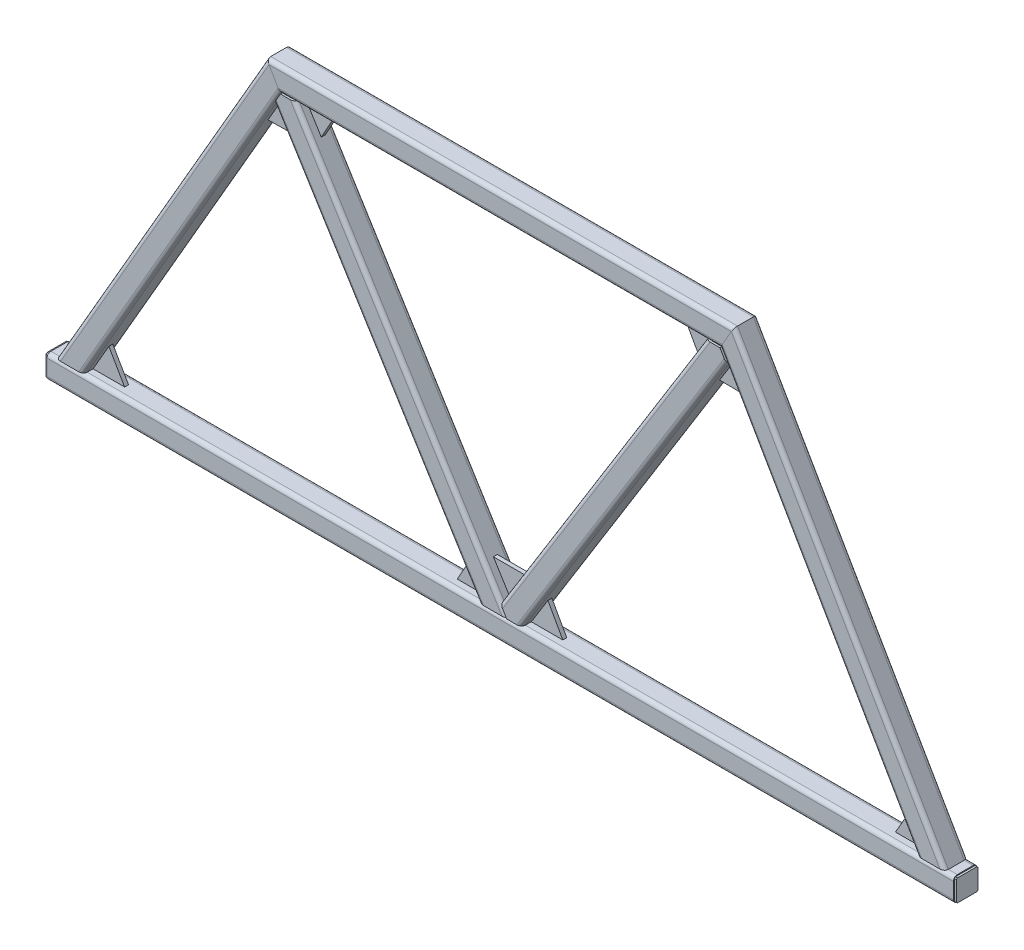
SolidWorks part; units mm, degrees
ref_plane "Front Plane" through (0, 0, 0) normal (0, 0, 1) x (1, 0, 0)
ref_plane "Top Plane" through (0, 0, 0) normal (0, 1, 0) x (1, 0, 0)
ref_plane "Right Plane" through (0, 0, 0) normal (1, 0, 0) x (0, 0, -1)
sketch "Sketch 01" plane through (0, 0, 0) normal (0, 0, 1) x (1, 0, 0)
  line L0 (-1460.5, 0) -> (1460.5, 0)
  dimension "D1" = 2921
  dimension "D2" = 1460.5
sketch "Sketch 02" plane through (0, 0, 0) normal (0, 0, 1) x (1, 0, 0)
  line L0 (-1409.7, 0) -> (-730.25, 1176.8419)
  line L1 (1409.7, 0) -> (730.25, 1176.8419)
  line L2 (-730.25, 1176.8419) -> (730.25, 1176.8419)
  line L5 (-1460.5, 0) -> (1460.5, 0) construction
  dimension "D1" = 50.8
  dimension "D2" = 50.8
  dimension "D3" = 60
  dimension "D4" = 60
  dimension "D5" = 1460.5
sketch "Sketch16" plane through (0, 0, 0) normal (0, 0, 1) x (1, 0, 0)
  line L0 (-730.25, 1176.8419) -> (0, 0)
  line L1 (-1460.5, 0) -> (1460.5, 0) construction
  line L2 (730.25, 1176.8419) -> (0, 0)
other "Structural Member1"
ref_plane "Plane1" through (-1460.5, 0, 0) normal (1, 0, 0) x (0, 1, 0)
sketch "Sketch1" plane through (-1460.5, 0, 0) normal (1, 0, 0) x (0, 1, 0)
  line L0 (-25.4, -31.75) -> (25.4, -31.75)
  line L1 (-31.75, -25.4) -> (-31.75, 25.4)
  line L2 (25.4, 31.75) -> (-25.4, 31.75)
  line L3 (31.75, 25.4) -> (31.75, -25.4)
  line L4 (-25.4, -38.1) -> (25.4, -38.1)
  line L5 (-38.1, -25.4) -> (-38.1, 25.4)
  line L6 (25.4, 38.1) -> (-25.4, 38.1)
  line L7 (38.1, 25.4) -> (38.1, -25.4)
  line L8 (0, 0) -> (31.75, 0) construction
  line L9 (0, 0) -> (0, 31.75) construction
  arc A0 (38.1, 25.4) -> (25.4, 38.1) centre (25.4, 25.4) ccw
  arc A1 (25.4, -38.1) -> (38.1, -25.4) centre (25.4, -25.4) ccw
  arc A2 (-38.1, -25.4) -> (-25.4, -38.1) centre (-25.4, -25.4) ccw
  arc A3 (-25.4, 38.1) -> (-38.1, 25.4) centre (-25.4, 25.4) ccw
  arc A4 (-25.4, 31.75) -> (-31.75, 25.4) centre (-25.4, 25.4) ccw
  arc A5 (31.75, 25.4) -> (25.4, 31.75) centre (25.4, 25.4) ccw
  arc A6 (25.4, -31.75) -> (31.75, -25.4) centre (25.4, -25.4) ccw
  arc A7 (-31.75, -25.4) -> (-25.4, -31.75) centre (-25.4, -25.4) ccw
  point P3 (0, 38.1)
  point P4 (38.1, 0)
  point P5 (0, -38.1)
  point P6 (-38.1, 0)
  point P7 (-38.1, 38.1)
  point P8 (-38.1, -38.1)
  point P33 (0, 0)
  point P35 (38.1, -38.1)
  point P36 (38.1, 38.1)
  point P37 (0, 0)
  dimension "D1" = 12.7
  dimension "Thickness" = 6.35
  dimension "V_leg" = 76.2
other "Structural Member2"
ref_plane "Plane2" through (1409.7, 0, 0) normal (-0.5, 0.866, 0) x (-0.866, -0.5, 0)
sketch "Sketch18" plane through (1409.7, 0, 0) normal (-0.5, 0.866, 0) x (-0.866, -0.5, 0)
  line L0 (-25.4, -31.75) -> (25.4, -31.75)
  line L1 (-31.75, -25.4) -> (-31.75, 25.4)
  line L2 (25.4, 31.75) -> (-25.4, 31.75)
  line L3 (31.75, 25.4) -> (31.75, -25.4)
  line L4 (-25.4, -38.1) -> (25.4, -38.1)
  line L5 (-38.1, -25.4) -> (-38.1, 25.4)
  line L6 (25.4, 38.1) -> (-25.4, 38.1)
  line L7 (38.1, 25.4) -> (38.1, -25.4)
  line L8 (0, 0) -> (31.75, 0) construction
  line L9 (0, 0) -> (0, 31.75) construction
  arc A0 (38.1, 25.4) -> (25.4, 38.1) centre (25.4, 25.4) ccw
  arc A1 (25.4, -38.1) -> (38.1, -25.4) centre (25.4, -25.4) ccw
  arc A2 (-38.1, -25.4) -> (-25.4, -38.1) centre (-25.4, -25.4) ccw
  arc A3 (-25.4, 38.1) -> (-38.1, 25.4) centre (-25.4, 25.4) ccw
  arc A4 (-25.4, 31.75) -> (-31.75, 25.4) centre (-25.4, 25.4) ccw
  arc A5 (31.75, 25.4) -> (25.4, 31.75) centre (25.4, 25.4) ccw
  arc A6 (25.4, -31.75) -> (31.75, -25.4) centre (25.4, -25.4) ccw
  arc A7 (-31.75, -25.4) -> (-25.4, -31.75) centre (-25.4, -25.4) ccw
  point P3 (0, 38.1)
  point P4 (38.1, 0)
  point P5 (0, -38.1)
  point P6 (-38.1, 0)
  point P7 (-38.1, 38.1)
  point P8 (-38.1, -38.1)
  point P33 (0, 0)
  point P35 (38.1, -38.1)
  point P36 (38.1, 38.1)
  point P37 (0, 0)
  dimension "D1" = 12.7
  dimension "Thickness" = 6.35
  dimension "V_leg" = 76.2
other "Structural Member3"
ref_plane "Plane3" through (-730.25, 1176.8419, 0) normal (1, 0, 0) x (0, 1, 0)
sketch "Sketch110" plane through (-730.25, 1176.8419, 0) normal (1, 0, 0) x (0, 1, 0)
  line L0 (-25.4, -31.75) -> (25.4, -31.75)
  line L1 (-31.75, -25.4) -> (-31.75, 25.4)
  line L2 (25.4, 31.75) -> (-25.4, 31.75)
  line L3 (31.75, 25.4) -> (31.75, -25.4)
  line L4 (-25.4, -38.1) -> (25.4, -38.1)
  line L5 (-38.1, -25.4) -> (-38.1, 25.4)
  line L6 (25.4, 38.1) -> (-25.4, 38.1)
  line L7 (38.1, 25.4) -> (38.1, -25.4)
  line L8 (0, 0) -> (31.75, 0) construction
  line L9 (0, 0) -> (0, 31.75) construction
  arc A0 (38.1, 25.4) -> (25.4, 38.1) centre (25.4, 25.4) ccw
  arc A1 (25.4, -38.1) -> (38.1, -25.4) centre (25.4, -25.4) ccw
  arc A2 (-38.1, -25.4) -> (-25.4, -38.1) centre (-25.4, -25.4) ccw
  arc A3 (-25.4, 38.1) -> (-38.1, 25.4) centre (-25.4, 25.4) ccw
  arc A4 (-25.4, 31.75) -> (-31.75, 25.4) centre (-25.4, 25.4) ccw
  arc A5 (31.75, 25.4) -> (25.4, 31.75) centre (25.4, 25.4) ccw
  arc A6 (25.4, -31.75) -> (31.75, -25.4) centre (25.4, -25.4) ccw
  arc A7 (-31.75, -25.4) -> (-25.4, -31.75) centre (-25.4, -25.4) ccw
  point P3 (0, 38.1)
  point P4 (38.1, 0)
  point P5 (0, -38.1)
  point P6 (-38.1, 0)
  point P7 (-38.1, 38.1)
  point P8 (-38.1, -38.1)
  point P33 (0, 0)
  point P35 (38.1, -38.1)
  point P36 (38.1, 38.1)
  point P37 (0, 0)
  dimension "D1" = 12.7
  dimension "Thickness" = 6.35
  dimension "V_leg" = 76.2
other "Structural Member4"
ref_plane "Plane4" through (-1409.7, 0, 0) normal (0.5, 0.866, 0) x (-0.866, 0.5, 0)
sketch "Sketch111" plane through (-1409.7, 0, 0) normal (0.5, 0.866, 0) x (-0.866, 0.5, 0)
  line L0 (-25.4, -31.75) -> (25.4, -31.75)
  line L1 (-31.75, -25.4) -> (-31.75, 25.4)
  line L2 (25.4, 31.75) -> (-25.4, 31.75)
  line L3 (31.75, 25.4) -> (31.75, -25.4)
  line L4 (-25.4, -38.1) -> (25.4, -38.1)
  line L5 (-38.1, -25.4) -> (-38.1, 25.4)
  line L6 (25.4, 38.1) -> (-25.4, 38.1)
  line L7 (38.1, 25.4) -> (38.1, -25.4)
  line L8 (0, 0) -> (31.75, 0) construction
  line L9 (0, 0) -> (0, 31.75) construction
  arc A0 (38.1, 25.4) -> (25.4, 38.1) centre (25.4, 25.4) ccw
  arc A1 (25.4, -38.1) -> (38.1, -25.4) centre (25.4, -25.4) ccw
  arc A2 (-38.1, -25.4) -> (-25.4, -38.1) centre (-25.4, -25.4) ccw
  arc A3 (-25.4, 38.1) -> (-38.1, 25.4) centre (-25.4, 25.4) ccw
  arc A4 (-25.4, 31.75) -> (-31.75, 25.4) centre (-25.4, 25.4) ccw
  arc A5 (31.75, 25.4) -> (25.4, 31.75) centre (25.4, 25.4) ccw
  arc A6 (25.4, -31.75) -> (31.75, -25.4) centre (25.4, -25.4) ccw
  arc A7 (-31.75, -25.4) -> (-25.4, -31.75) centre (-25.4, -25.4) ccw
  point P3 (0, 38.1)
  point P4 (38.1, 0)
  point P5 (0, -38.1)
  point P6 (-38.1, 0)
  point P7 (-38.1, 38.1)
  point P8 (-38.1, -38.1)
  point P33 (0, 0)
  point P35 (38.1, -38.1)
  point P36 (38.1, 38.1)
  point P37 (0, 0)
  dimension "D1" = 12.7
  dimension "Thickness" = 6.35
  dimension "V_leg" = 76.2
other "Structural Member5"
ref_plane "Plane5" through (-730.25, 1176.8419, 0) normal (0.5273, -0.8497, 0) x (0.8497, 0.5273, 0)
sketch "Sketch112" plane through (-730.25, 1176.8419, 0) normal (0.5273, -0.8497, 0) x (0.8497, 0.5273, 0)
  line L0 (-25.4, -31.75) -> (25.4, -31.75)
  line L1 (-31.75, -25.4) -> (-31.75, 25.4)
  line L2 (25.4, 31.75) -> (-25.4, 31.75)
  line L3 (31.75, 25.4) -> (31.75, -25.4)
  line L4 (-25.4, -38.1) -> (25.4, -38.1)
  line L5 (-38.1, -25.4) -> (-38.1, 25.4)
  line L6 (25.4, 38.1) -> (-25.4, 38.1)
  line L7 (38.1, 25.4) -> (38.1, -25.4)
  line L8 (0, 0) -> (31.75, 0) construction
  line L9 (0, 0) -> (0, 31.75) construction
  arc A0 (38.1, 25.4) -> (25.4, 38.1) centre (25.4, 25.4) ccw
  arc A1 (25.4, -38.1) -> (38.1, -25.4) centre (25.4, -25.4) ccw
  arc A2 (-38.1, -25.4) -> (-25.4, -38.1) centre (-25.4, -25.4) ccw
  arc A3 (-25.4, 38.1) -> (-38.1, 25.4) centre (-25.4, 25.4) ccw
  arc A4 (-25.4, 31.75) -> (-31.75, 25.4) centre (-25.4, 25.4) ccw
  arc A5 (31.75, 25.4) -> (25.4, 31.75) centre (25.4, 25.4) ccw
  arc A6 (25.4, -31.75) -> (31.75, -25.4) centre (25.4, -25.4) ccw
  arc A7 (-31.75, -25.4) -> (-25.4, -31.75) centre (-25.4, -25.4) ccw
  point P3 (0, 38.1)
  point P4 (38.1, 0)
  point P5 (0, -38.1)
  point P6 (-38.1, 0)
  point P7 (-38.1, 38.1)
  point P8 (-38.1, -38.1)
  point P33 (0, 0)
  point P35 (38.1, -38.1)
  point P36 (38.1, 38.1)
  point P37 (0, 0)
  dimension "D1" = 12.7
  dimension "Thickness" = 6.35
  dimension "V_leg" = 76.2
other "Structural Member6"
ref_plane "Plane6" through (730.25, 1176.8419, 0) normal (-0.5273, -0.8497, 0) x (0.8497, -0.5273, 0)
sketch "Sketch113" plane through (730.25, 1176.8419, 0) normal (-0.5273, -0.8497, 0) x (0.8497, -0.5273, 0)
  line L0 (-25.4, -31.75) -> (25.4, -31.75)
  line L1 (-31.75, -25.4) -> (-31.75, 25.4)
  line L2 (25.4, 31.75) -> (-25.4, 31.75)
  line L3 (31.75, 25.4) -> (31.75, -25.4)
  line L4 (-25.4, -38.1) -> (25.4, -38.1)
  line L5 (-38.1, -25.4) -> (-38.1, 25.4)
  line L6 (25.4, 38.1) -> (-25.4, 38.1)
  line L7 (38.1, 25.4) -> (38.1, -25.4)
  line L8 (0, 0) -> (31.75, 0) construction
  line L9 (0, 0) -> (0, 31.75) construction
  arc A0 (38.1, 25.4) -> (25.4, 38.1) centre (25.4, 25.4) ccw
  arc A1 (25.4, -38.1) -> (38.1, -25.4) centre (25.4, -25.4) ccw
  arc A2 (-38.1, -25.4) -> (-25.4, -38.1) centre (-25.4, -25.4) ccw
  arc A3 (-25.4, 38.1) -> (-38.1, 25.4) centre (-25.4, 25.4) ccw
  arc A4 (-25.4, 31.75) -> (-31.75, 25.4) centre (-25.4, 25.4) ccw
  arc A5 (31.75, 25.4) -> (25.4, 31.75) centre (25.4, 25.4) ccw
  arc A6 (25.4, -31.75) -> (31.75, -25.4) centre (25.4, -25.4) ccw
  arc A7 (-31.75, -25.4) -> (-25.4, -31.75) centre (-25.4, -25.4) ccw
  point P3 (0, 38.1)
  point P4 (38.1, 0)
  point P5 (0, -38.1)
  point P6 (-38.1, 0)
  point P7 (-38.1, 38.1)
  point P8 (-38.1, -38.1)
  point P33 (0, 0)
  point P35 (38.1, -38.1)
  point P36 (38.1, 38.1)
  point P37 (0, 0)
  dimension "D1" = 12.7
  dimension "Thickness" = 6.35
  dimension "V_leg" = 76.2
other "Trim/Extend1"
other "Trim/Extend2"
other "Trim/Extend3"
other "Trim/Extend4"
other "Trim/Extend5"
other "Trim/Extend6"
other "Trim/Extend7"
other "Trim/Extend8"
other "Gusset6" parameters "D1"=12.7, "D2"=12.7, "D3"=0, "D4"=0, "D10"=6.35, "D11"=101.6, "D12"=101.6, "D13"=12.7, "D14"=45, "D15"=12.7, "D16"=50.8, "D17"=50.8, "D18"=45
sketch "Sketch119" plane through (-729.0719, 1102.6825, -6.35) normal (0, 0, 1) x (1, 0, 0)
  line L0 (0, 0) -> (53.5693, -86.3301)
  line L1 (0, 0) -> (-50.8, -87.9882)
  line L2 (53.5693, -86.3301) -> (-50.8, -87.9882)
other "Gusset7" parameters "D1"=12.7, "D2"=12.7, "D3"=0, "D4"=0, "D10"=6.35, "D11"=101.6, "D12"=101.6, "D13"=12.7, "D14"=45, "D15"=12.7
sketch "Sketch120" plane through (-661.7693, 1138.7419, 6.35) normal (0, 0, -1) x (-1, 0, 0)
  line L0 (0, 0) -> (-53.5693, -86.3301)
  line L1 (0, 0) -> (-101.6, 0)
  line L2 (-53.5693, -86.3301) -> (-101.6, 0)
other "Gusset8" parameters "D1"=12.7, "D2"=12.7, "D3"=0, "D4"=0, "D10"=6.35, "D11"=101.6, "D12"=101.6, "D13"=12.7, "D14"=45, "D15"=12.7
sketch "Sketch121" plane through (661.7693, 1138.7419, -6.35) normal (0, 0, 1) x (1, 0, 0)
  line L0 (0, 0) -> (-101.6, 0)
  line L1 (0, 0) -> (-53.5693, -86.3301)
  line L2 (-101.6, 0) -> (-53.5693, -86.3301)
other "Gusset9" parameters "D1"=12.7, "D2"=12.7, "D3"=0, "D4"=0, "D10"=6.35, "D11"=101.6, "D12"=101.6, "D13"=12.7, "D14"=45, "D15"=12.7
sketch "Sketch122" plane through (729.0719, 1102.6825, 6.35) normal (0, 0, -1) x (-1, 0, 0)
  line L0 (0, 0) -> (-50.8, -87.9882)
  line L1 (0, 0) -> (53.5693, -86.3301)
  line L2 (-50.8, -87.9882) -> (53.5693, -86.3301)
other "Gusset1" parameters "D1"=12.7, "D2"=25.4, "D3"=0, "D4"=0, "D10"=6.35, "D11"=101.6, "D12"=101.6, "D13"=12.7, "D14"=45, "D15"=12.7
sketch "Sketch114" plane through (-1343.7089, 38.1, -6.35) normal (0, 0, 1) x (1, 0, 0)
  line L0 (0, 0) -> (50.8, 87.9882)
  line L1 (0, 0) -> (101.6, 0)
  line L2 (50.8, 87.9882) -> (101.6, 0)
other "Gusset2" parameters "D1"=12.7, "D2"=12.7, "D3"=0, "D4"=0, "D10"=6.35, "D11"=101.6, "D12"=101.6, "D13"=12.7, "D14"=45, "D15"=12.7
sketch "Sketch115" plane through (-68.4807, 38.1, 6.35) normal (0, 0, -1) x (-1, 0, 0)
  line L0 (0, 0) -> (101.6, 0)
  line L1 (0, 0) -> (53.5693, 86.3301)
  line L2 (101.6, 0) -> (53.5693, 86.3301)
other "Gusset3" parameters "D1"=12.7, "D2"=12.7, "D3"=0, "D4"=0, "D10"=6.35, "D11"=101.6, "D12"=101.6, "D13"=12.7, "D14"=45, "D15"=12.7
sketch "Sketch116" plane through (0, 72.2608, 6.35) normal (0, 0, -1) x (-1, 0, 0)
  line L0 (0, 0) -> (-53.5693, 86.3301)
  line L1 (0, 0) -> (53.5693, 86.3301)
  line L2 (-53.5693, 86.3301) -> (53.5693, 86.3301)
other "Gusset4" parameters "D1"=12.7, "D2"=12.7, "D3"=0, "D4"=0, "D10"=6.35, "D11"=101.6, "D12"=101.6, "D13"=12.7, "D14"=45, "D15"=12.7
sketch "Sketch117" plane through (68.4807, 38.1, -6.35) normal (0, 0, 1) x (1, 0, 0)
  line L0 (0, 0) -> (53.5693, 86.3301)
  line L1 (0, 0) -> (101.6, 0)
  line L2 (53.5693, 86.3301) -> (101.6, 0)
other "Gusset5" parameters "D1"=12.7, "D2"=12.7, "D3"=0, "D4"=0, "D10"=6.35, "D11"=101.6, "D12"=101.6, "D13"=12.7, "D14"=45, "D15"=12.7
sketch "Sketch118" plane through (1343.7089, 38.1, 6.35) normal (0, 0, -1) x (-1, 0, 0)
  line L0 (0, 0) -> (101.6, 0)
  line L1 (0, 0) -> (50.8, 87.9882)
  line L2 (101.6, 0) -> (50.8, 87.9882)
other "End cap1" parameters "D1"=6.35, "D2"=3.175, "D3"=3.175
other "End cap2" parameters "D1"=6.35, "D2"=3.175, "D3"=3.175
